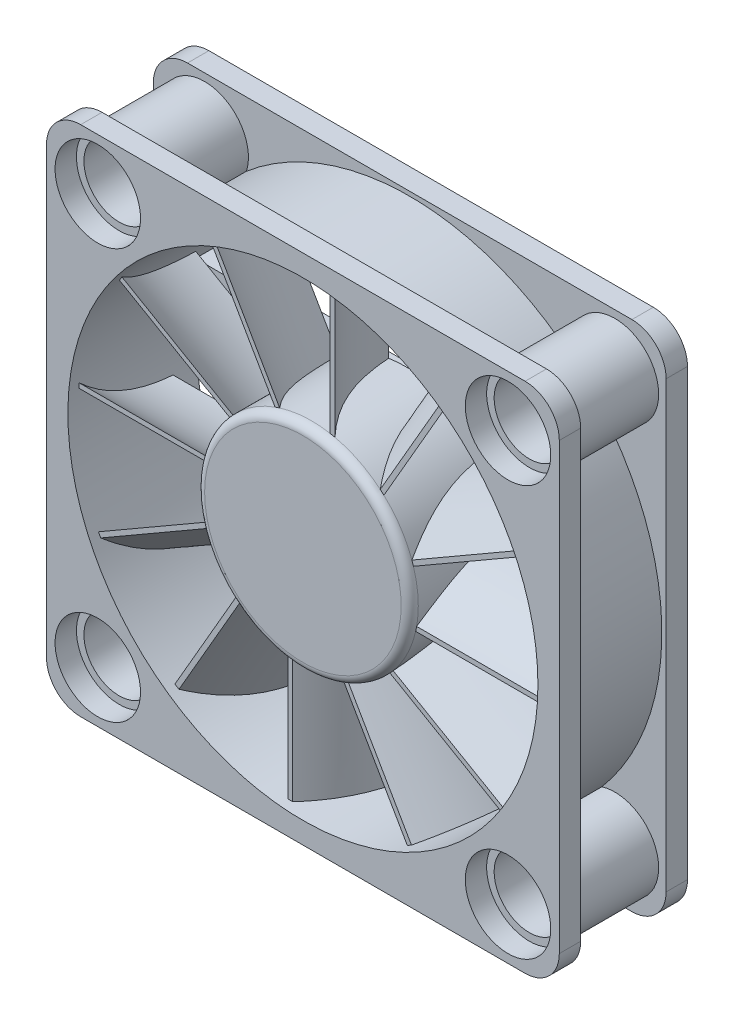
SolidWorks part; units mm, degrees
ref_plane "Front Plane" through (0, 0, 0) normal (0, 0, 1) x (1, 0, 0)
ref_plane "Top Plane" through (0, 0, 0) normal (0, 1, 0) x (1, 0, 0)
ref_plane "Right Plane" through (0, 0, 0) normal (1, 0, 0) x (0, 0, -1)
sketch "Sketch1" plane through (0, 0, 0) normal (0, 0, 1) x (1, 0, 0)
  line L1 (-27.6482, 24.7228) -> (32.3518, 24.7228)
  line L2 (-27.6482, 24.7228) -> (-27.6482, -35.2772)
  line L3 (-27.6482, -35.2772) -> (32.3518, -35.2772)
  line L4 (32.3518, 24.7228) -> (32.3518, -35.2772)
  circle A0 centre (2.3518, -5.2772) radius 27.5
  circle A1 centre (-21.6482, 18.7228) radius 5
  circle A2 centre (26.3518, 18.7228) radius 5
  circle A3 centre (26.3518, -29.2772) radius 5
  circle A4 centre (-21.6482, -29.2772) radius 5
  dimension "D5" = 55
  dimension "D8" = 10
  dimension "D1" = 60
  dimension "D2" = 60
  dimension "D3" = 30
  dimension "D4" = 30
  dimension "D6" = 6
  dimension "D7" = 6
  dimension "D9" = 2
  dimension "D10" = 2
extrude "Boss-Extrude1" add sketch "Sketch1" along normal blind 15
ref_plane "Plane1" through (0, 0, 7.5) normal (0, 0, 1) x (1, 0, 0)
sketch "Sketch2" plane through (0, 0, 7.5) normal (0, 0, 1) x (1, 0, 0)
  line L0 (-27.6482, -35.2772) -> (32.3518, -35.2772) construction
  line L1 (32.3518, -35.2772) -> (32.3518, 24.7228) construction
  line L2 (-27.6482, 24.7228) -> (-27.6482, -35.2772) construction
  line L3 (32.3518, 24.7228) -> (-27.6482, 24.7228) construction
  line L4 (-27.6482, -35.2772) -> (32.3518, -35.2772)
  line L5 (32.3518, -35.2772) -> (32.3518, 24.7228)
  line L6 (-27.6482, 24.7228) -> (-27.6482, -35.2772)
  line L7 (32.3518, 24.7228) -> (-27.6482, 24.7228)
  circle A0 centre (2.3518, -5.2772) radius 29.5
  circle A1 centre (2.3518, -5.2772) radius 27.5 construction
  dimension "D1" = 2
extrude "Cut-Extrude1" cut sketch "Sketch2" against normal blind 5 and the other way blind 5
fillet "Fillet1" radius 4 8 edges at (32.3518, -35.2772, 13.75) (32.3518, -35.2772, 1.25) (32.3518, 24.7228, 13.75) (32.3518, 24.7228, 1.25) (-27.6482, -35.2772, 1.25) (-27.6482, -35.2772, 13.75) (-27.6482, 24.7228, 1.25) (-27.6482, 24.7228, 13.75)
sketch "Sketch3" plane through (0, 0, 12.5) normal (0, 0, -1) x (-1, 0, 0)
  circle A1 centre (-26.3518, 18.7228) radius 5.125
  circle A2 centre (-26.3518, 18.7228) radius 4.125
  dimension "D1" = 1
  dimension "D2" = 10.25
extrude "Boss-Extrude3" add sketch "Sketch3" along normal blind 10
ref_plane "Plane2" through (2.3518, 0, 0) normal (1, 0, 0) x (0, 0, -1)
ref_plane "Plane3" through (0, -5.2772, 0) normal (0, 1, 0) x (1, 0, 0)
mirror "Mirror1" about plane through (2.3518, 0, 0) normal (1, 0, 0) of "Boss-Extrude3"
mirror "Mirror2" about plane through (0, -5.2772, 0) normal (0, 1, 0) of "Mirror1", "Boss-Extrude3"
sketch "Sketch4" plane through (0, 0, 0) normal (0, 0, -1) x (-1, 0, 0)
  line L0 (-2.3518, 4.7228) -> (23.1927, 4.9073)
  line L1 (24.4205, 1.0072) -> (5.4267, 1.0072)
  line L2 (-2.3518, 1.375) -> (-2.3518, -1.375) construction
  line L3 (-29.8518, -5.2772) -> (25.1482, -5.2772) construction
  line L4 (1.375, -5.2772) -> (-1.375, -5.2772) construction
  line L5 (-2.3518, -32.7772) -> (-2.3518, 22.2228) construction
  line L8 (-2.3518, -15.2772) -> (-27.8964, -15.4618)
  line L9 (-29.1315, -11.5301) -> (-10.1303, -11.5617)
  line L10 (-8.6046, 21.5025) -> (-8.6363, 2.5013)
  line L11 (-12.3518, -5.2772) -> (-12.5364, 20.2673)
  line L12 (3.9327, -32.0495) -> (3.9327, -13.0558)
  line L13 (7.6482, -5.2772) -> (7.8328, -30.8218)
  circle A1 centre (-2.3518, -5.2772) radius 27.5 construction
  arc A2 (-2.3518, 4.7228) -> (5.4267, 1.0072) centre (-2.3518, -5.2772) cw
  arc A3 (23.1927, 4.9073) -> (24.4205, 1.0072) centre (-2.3518, -5.2772) cw
  arc A6 (-27.8964, -15.4618) -> (-29.1315, -11.5301) centre (-2.3518, -5.2772) cw
  arc A7 (-10.1303, -11.5617) -> (-2.3518, -15.2772) centre (-2.3518, -5.2772) ccw
  arc A8 (-8.6363, 2.5013) -> (-12.3518, -5.2772) centre (-2.3518, -5.2772) ccw
  arc A9 (-12.5364, 20.2673) -> (-8.6046, 21.5025) centre (-2.3518, -5.2772) cw
  arc A10 (7.6482, -5.2772) -> (3.9327, -13.0558) centre (-2.3518, -5.2772) cw
  arc A11 (7.8328, -30.8218) -> (3.9327, -32.0495) centre (-2.3518, -5.2772) cw
  circle A12 centre (-2.3518, -5.2772) radius 10
  point P29 (-2.3518, -5.2772)
  point P31 (-2.3518, -5.2772)
  dimension "D1" = 2
  dimension "D2" = 10
  dimension "D4" = 2
extrude "Boss-Extrude4" add sketch "Sketch4" against normal blind 2
sketch "Sketch5" plane through (0, 0, 2) normal (0, 0, 1) x (1, 0, 0)
  circle A0 centre (2.3518, -5.2772) radius 12.5
  dimension "D1" = 25
extrude "Boss-Extrude5" add sketch "Sketch5" along normal blind 12 from offset 1 separate body
fillet "Fillet2" radius 1 1 edges at (14.8518, -5.2772, 15)
sketch "Sketch6" plane through (0, -5.2772, 0) normal (0, 1, 0) x (1, 0, 0)
  line L3 (14.8518, -14) -> (-10.1482, -14) construction
  line L9 (14.8518, -3) -> (-10.1482, -3) construction
  line L11 (-0.1504, -3) -> (0.3866, -3)
  line L13 (4.5413, -14) -> (5.1, -14)
  spline S0 degree 2 poles (0.3866, -3) (0.8548, -9.4289) (5.1, -14) knots 0 0 0 1 1 1
  spline S1 degree 2 poles (-0.1504, -3) (0.3216, -9.4179) (4.5413, -14) knots 0 0 0 1 1 1
extrude "Boss-Extrude6" add sketch "Sketch6" along normal blind 17.2 from offset 10
sketch "Sketch7" plane through (0, 0, 15) normal (0, 0, 1) x (1, 0, 0)
  line L0 (-0.1504, 21.9228) -> (-0.1504, 6.9697) construction
  line L1 (5.1, 21.9228) -> (5.1, 6.9169) construction
  line L2 (-0.1504, 22.0068) -> (-0.1504, 21.7609)
  line L3 (5.1, 21.9831) -> (5.1, 21.737)
  arc A0 (-0.1504, 21.7609) -> (5.1, 21.737) centre (2.3518, -5.2772) cw
  arc A1 (-0.1504, 22.0068) -> (5.1, 21.9831) centre (2.3518, -5.2772) cw
extrude "Cut-Extrude2" cut sketch "Sketch7" against normal blind 12
sketch "Sketch8" plane through (2.3518, 0, 0) normal (1, 0, 0) x (0, 0, -1)
  line L0 (0, -5.2772) -> (-15.9705, -5.2772) construction
  line L1 (0, -31.2772) -> (0, 20.7228) construction
  line L2 (1.375, -5.2772) -> (-1.375, -5.2772) construction
pattern_circular "CirPattern1" count 12 every 30 about axis through (2.3518, -5.2772, 0) along (0, 0, 1) of "Boss-Extrude6"
